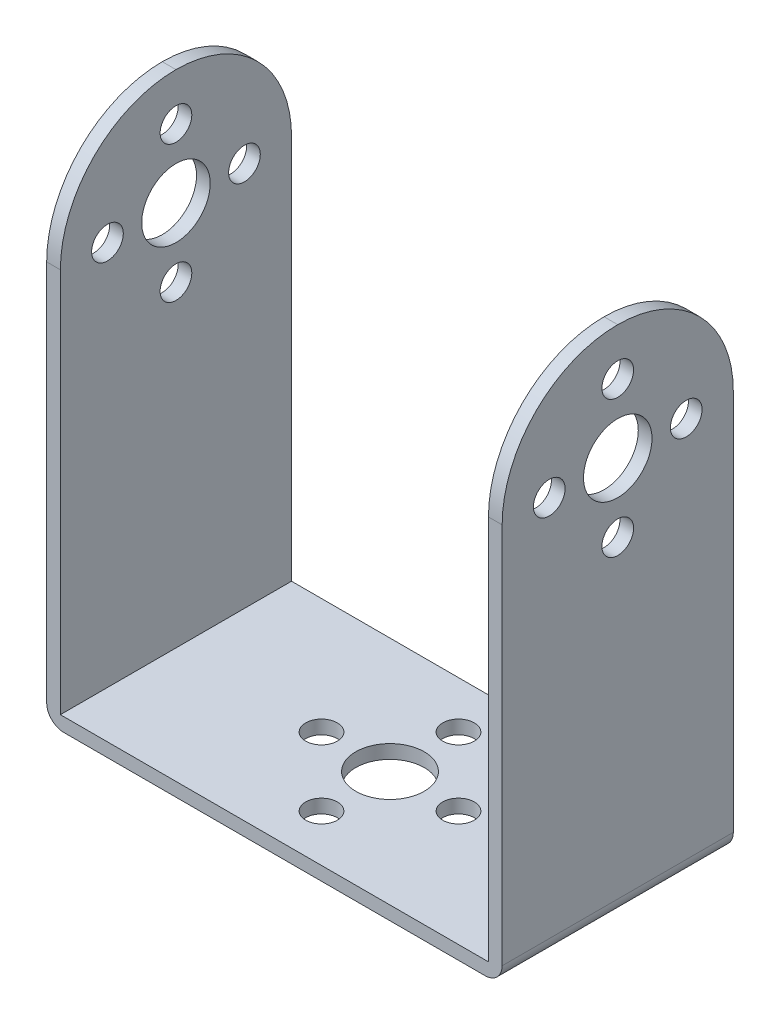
SolidWorks part; units mm, degrees
ref_plane "Front Plane" through (0, 0, 0) normal (0, 0, 1) x (1, 0, 0)
ref_plane "Top Plane" through (0, 0, 0) normal (0, 1, 0) x (1, 0, 0)
ref_plane "Right Plane" through (0, 0, 0) normal (1, 0, 0) x (0, 0, -1)
sketch "Sketch1" plane through (0, 0, 0) normal (0, 0, 1) x (1, 0, 0)
  line L0 (0, 0) -> (53.2, 0)
  line L1 (53.2, 0) -> (53.2, 60.1)
  line L2 (53.2, 60.1) -> (51.6, 60.1)
  line L3 (51.6, 60.1) -> (51.6, 1.6)
  line L4 (51.6, 1.6) -> (1.6, 1.6)
  line L5 (1.6, 1.6) -> (1.6, 60.1)
  line L6 (1.6, 60.1) -> (0, 60.1)
  line L7 (0, 60.1) -> (0, 0)
  dimension "D1" = 1.6
  dimension "D2" = 1.6
  dimension "D3" = 53.2
  dimension "D4" = 1.6
  dimension "D5" = 60.1
  dimension "D6" = 60.1
extrude "Extrude1" add sketch "Sketch1" against normal blind 27
fillet "Fillet2" radius 13.5 1 edges at (52.4, 60.1, 0)
fillet "Fillet3" radius 13.5 1 edges at (52.4, 60.1, -27)
fillet "Fillet4" radius 13.5 1 edges at (0.8, 60.1, -27)
fillet "Fillet5" radius 13.5 1 edges at (0.8, 60.1, 0)
sketch "Sketch3" plane through (53.2, 0, 0) normal (1, 0, 0) x (0, 0, -1)
  line L0 (27, 0) -> (0, 0) construction
  line L1 (0, 0) -> (0, 46.6) construction
  dimension "D1" = 46.6
  dimension "D2" = 13.5
sketch_block_instance "Block4-1"
sketch_block "Block4"
extrude "Cut-Extrude1" cut sketch "Sketch3" against normal through all
sketch "Sketch4" plane through (0, 0, 0) normal (0, -1, 0) x (1, 0, 0)
  line L0 (0, -27) -> (0, 0) construction
  line L1 (0, -27) -> (53.2, -27) construction
  dimension "D1" = 26.6
  dimension "D2" = 13.5
sketch_block_instance "Block4-2"
extrude "Cut-Extrude2" cut sketch "Sketch4" against normal blind 27
fillet "Fillet6" radius 2 1 edges at (53.2, 0, -13.5)
fillet "Fillet7" radius 2 1 edges at (0, 0, -13.5)
